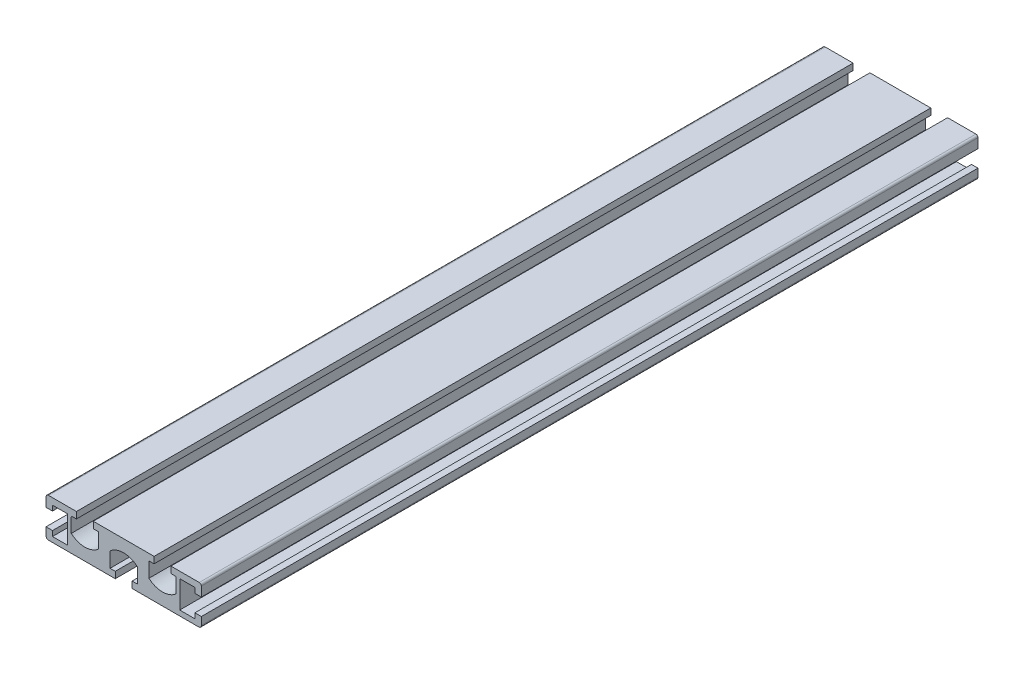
SolidWorks part; units mm, degrees
ref_plane "前视基准面" through (0, 0, 0) normal (0, 0, 1) x (1, 0, 0)
ref_plane "上视基准面" through (0, 0, 0) normal (0, 1, 0) x (1, 0, 0)
ref_plane "右视基准面" through (0, 0, 0) normal (1, 0, 0) x (0, 0, -1)
sketch "草图1"
sketch_block_instance "A$C1BB330BB-2"
sketch_block "A$C1BB330BB"
extrude "凸台-拉伸1" add sketch "草图1" along normal mid plane 300
